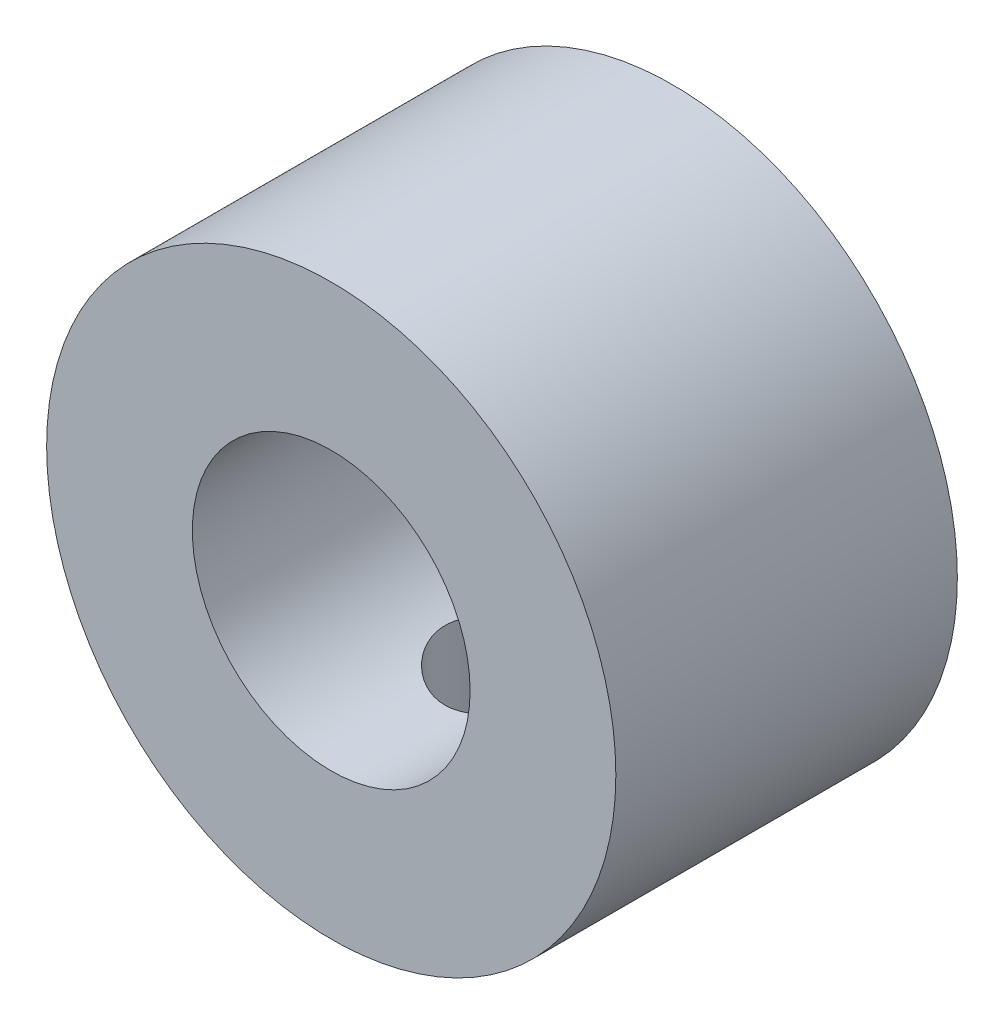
SolidWorks part; units mm, degrees
ref_plane "Plan de face" through (0, 0, 0) normal (0, 0, 1) x (1, 0, 0)
ref_plane "Plan de dessus" through (0, 0, 0) normal (0, 1, 0) x (1, 0, 0)
ref_plane "Plan de droite" through (0, 0, 0) normal (1, 0, 0) x (0, 0, -1)
sketch "Esquisse1" plane through (0, 0, 0) normal (0, 0, 1) x (1, 0, 0)
  circle A0 centre (0, 0) radius 12.5
  dimension "D1" = 25
extrude "Extru.-Mince1" add sketch "Esquisse1" along normal mid plane 15 thin
hole_wizard "Trou taraudé M6x1.02" positions "Esquisse3D1" profile "Esquisse18" tap size "M6x1.0" standard "DIN"
sketch3d "Esquisse3D1"
  point P0 (0, -12.5, 0)
  dimension "D1" = 7.5
sketch "Esquisse18" plane through (0, -12.5, 0) normal (1, 0, 0) x (0, 0, -1)
  line L0 (0, 0) -> (0, 6.4)
  line L1 (0, 6.4) -> (2.5, 6.4)
  line L2 (2.5, 6.4) -> (2.5, 0)
  line L5 (2.5, 0) -> (0, 0)
  line L11 (0, -6.35) -> (0, 107.95) construction
  dimension "Diamètre du trou pour taraudage jusqu'au prochain" = 5
  dimension "Profondeur du trou pour taraudage jusqu'au prochain" = 6.4
